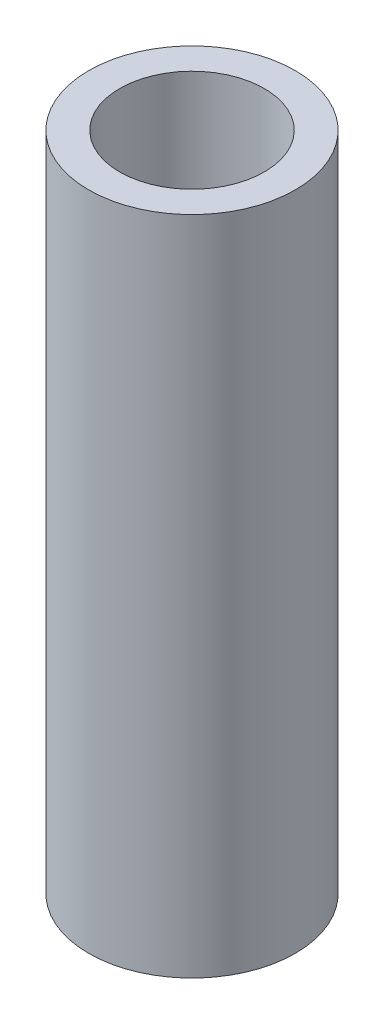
SolidWorks part; units mm, degrees
ref_plane "Front Plane" through (0, 0, 0) normal (0, 0, 1) x (1, 0, 0)
ref_plane "Top Plane" through (0, 0, 0) normal (0, 1, 0) x (1, 0, 0)
ref_plane "Right Plane" through (0, 0, 0) normal (1, 0, 0) x (0, 0, -1)
sketch "Sketch1" plane through (0, 0, 0) normal (0, 1, 0) x (1, 0, 0)
  circle A0 centre (0, 0) radius 5.5562
  circle A1 centre (0, 0) radius 7.9375
  circle A2 centre (0, 0) radius 5.5562 construction
  dimension "D2" = 15.875
extrude "Extrude1" add sketch "Sketch1" along normal blind 50.8
